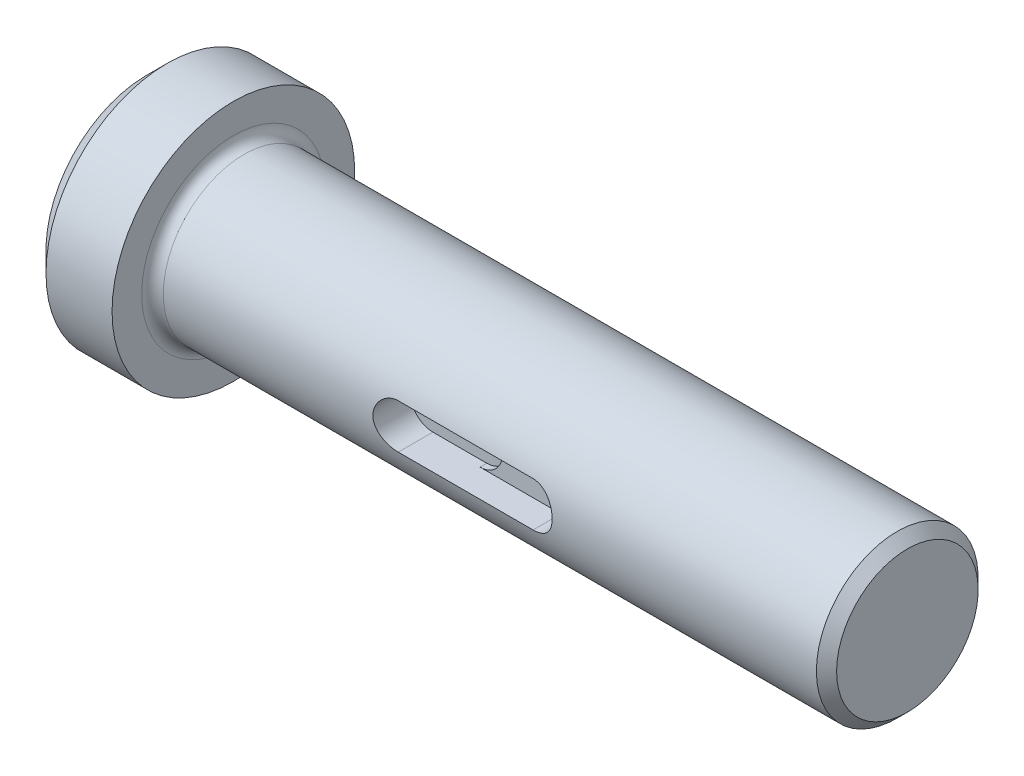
SolidWorks part; units mm, degrees
ref_plane "Front" through (0, 0, 0) normal (0, 0, 1) x (1, 0, 0)
ref_plane "Top" through (0, 0, 0) normal (0, 1, 0) x (1, 0, 0)
ref_plane "Right" through (0, 0, 0) normal (1, 0, 0) x (0, 0, -1)
sketch "Sketch2" plane through (0, 0, 0) normal (0, 0, 1) x (1, 0, 0)
  line L0 (-56.0675, 0) -> (68.4436, 0) construction
  line L1 (0, 0) -> (0, 9)
  line L2 (0, 9) -> (6.4, 9)
  line L3 (6.4, 9) -> (6.4, 6.8)
  line L4 (7.2, 6) -> (56.4, 6)
  line L5 (56.4, 6) -> (56.4, 0)
  line L6 (56.4, 0) -> (0, 0)
  arc A0 (7.2, 6) -> (6.4, 6.8) centre (7.2, 6.8) cw
  dimension "r" = 0.8
  dimension "d" = 12
  dimension "dk" = 18
  dimension "k" = 6.4
  dimension "l" = 50
revolve "Base" add sketch "Sketch2" angle 360 about L0
chamfer "HeadChamfer" distance 1.5 angle 45 1 edges at (0, 0, 9)
ref_plane "Plane1" through (0, 0, 6) normal (0, 0, 1) x (1, 0, 0)
sketch "Sketch3" plane through (0, 0, 6) normal (0, 0, 1) x (1, 0, 0)
  line L0 (0, 0) -> (53.5043, 0) construction
  line L2 (24.4, 1.65) -> (34.4, 1.65)
  line L3 (34.4, -1.65) -> (24.4, -1.65)
  line L6 (6.4, -9) -> (6.4, 9) construction
  arc A0 (34.4, 1.65) -> (34.4, -1.65) centre (34.4, 0) cw
  arc A1 (24.4, -1.65) -> (24.4, 1.65) centre (24.4, 0) cw
  dimension "n" = 3.3
  dimension "l1" = 18
  dimension "l2" = 10
extrude "Cut-Extrude1" cut sketch "Sketch3" against normal blind 2.3
sketch "Sketch4" plane through (0, 0, 6) normal (0, 0, 1) x (1, 0, 0)
  line L4 (24.4, 1.65) -> (34.4, 1.65) construction
  line L5 (34.4, -1.65) -> (24.4, -1.65) construction
  line L6 (24.4, 1.65) -> (28.4, 1.65)
  line L7 (28.4, -1.65) -> (24.4, -1.65)
  arc A0 (28.4, -1.65) -> (28.4, 1.65) centre (28.4, 0) ccw
  arc A1 (24.4, 1.65) -> (24.4, -1.65) centre (24.4, 0) ccw construction
  arc A2 (24.4, 1.65) -> (24.4, -1.65) centre (24.4, 0) ccw
  dimension "l3" = 4
extrude "Cut-Extrude2" cut sketch "Sketch4" against normal blind 2.8
chamfer "BodyChamfer" distance 0.75 angle 45 1 edges at (56.4, 0, 6)
sketch "Sketch5" plane through (0, 0, 0) normal (0, 0, 1) x (1, 0, 0)
  line L0 (54.1917, 7.4583) -> (55.65, 7.4583)
  line L1 (55.65, 7.4583) -> (55.65, 6)
  line L2 (55.65, 6) -> (54.9208, 4.737)
  line L3 (54.9208, 4.737) -> (54.1917, 6)
  line L4 (54.1917, 6) -> (54.1917, 7.4583)
  line L6 (55.65, 6) -> (7.2, 6) construction
  line L7 (55.65, 6) -> (55.65, -6) construction
  dimension "D1" = 1.4583
revolve "Cut-Revolve10" [suppressed] cut sketch "Sketch5" angle 360 about axis through (-56.0675, 0, 0) along (1, 0, 0)
pattern_linear "LPattern10" [suppressed] count 8 along (1, 0, 0)
equation "\"D1@Plane1\" = \"d@Sketch2\" / 2"
equation "\"D1@BodyChamfer\" = \"c@HeadChamfer\" / 2"
equation "\"D1@Sketch5\" = \"pitch@LPattern10\" / 1.2"
equation "\"D1@LPattern10\" = ( \"b@ThreadCosmetic1\"  - \"D1@BodyChamfer\")/  \"pitch@LPattern10\""
